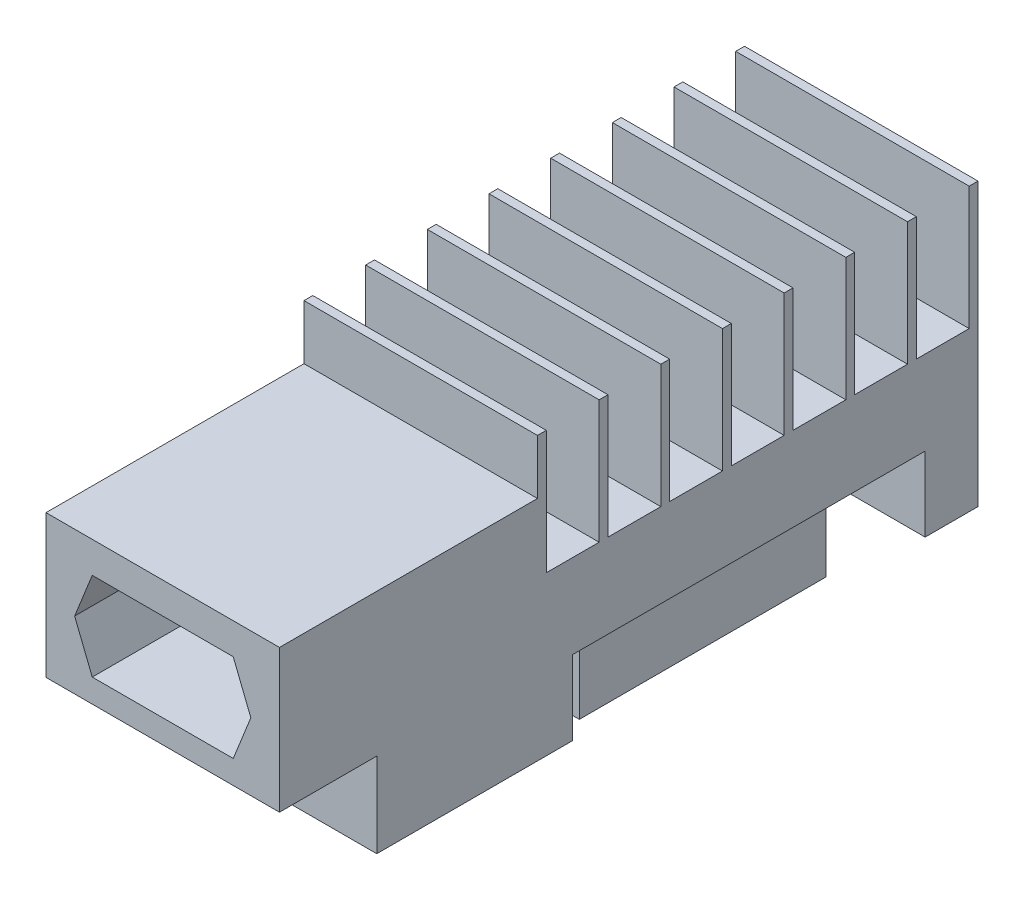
SolidWorks part; units mm, degrees
ref_plane "Plane1" through (0, 0, 0) normal (0, 0, 1) x (1, 0, 0)
ref_plane "Plane2" through (0, 0, 0) normal (0, 1, 0) x (1, 0, 0)
ref_plane "Plane3" through (0, 0, 0) normal (1, 0, 0) x (0, 0, -1)
ref_plane "Plane5" through (0, 16, 0) normal (0, 1, 0) x (-1, 0, 0)
sketch "Sketch2" plane through (0, 16, 0) normal (0, 1, 0) x (-1, 0, 0)
  line L0 (-6.625, 0) -> (6.625, 0)
  line L1 (6.625, 0) -> (6.625, 39.64)
  line L2 (6.625, 39.64) -> (-6.625, 39.64)
  line L3 (-6.625, 39.64) -> (-6.625, 0)
  dimension "D1" = 13.25
  dimension "D2" = 39.64
extrude "Extrude2" add sketch "Sketch2" against normal blind 16
sketch "Sketch3" plane through (-6.625, 0, 0) normal (-1, 0, 0) x (0, 0, 1)
  line L0 (3.5, 16) -> (0.5, 16)
  line L1 (0.5, 16) -> (0.5, 9)
  line L2 (0.5, 9) -> (3.5, 9)
  line L3 (3.5, 9) -> (3.5, 16)
  line L5 (0, 0) -> (0, 16) construction
  line L6 (0, 16) -> (39.64, 16) construction
  dimension "D1" = 7
  dimension "D2" = 0.5
  dimension "D3" = 3
extrude "Cut-Extrude1" cut sketch "Sketch3" against normal up to next
pattern_linear "LPattern1" count 7 spacing 3.5 along (0, 0, 1) of "Cut-Extrude1"
sketch "Sketch10" plane through (-6.625, 0, 0) normal (-1, 0, 0) x (0, 0, 1)
  line L0 (25, 12.9) -> (39.64, 12.9)
  line L1 (39.64, 12.9) -> (39.64, 16)
  line L2 (39.64, 16) -> (25, 16)
  line L3 (25, 16) -> (25, 12.9)
  line L4 (39.64, 0) -> (39.64, 16) construction
  line L5 (24.5, 16) -> (39.64, 16) construction
  line L6 (24.5, 9) -> (24.5, 16) construction
  dimension "D1" = 0.5
  dimension "D2" = 3.1
extrude "Cut-Extrude8" cut sketch "Sketch10" against normal up to next
sketch "Sketch11" plane through (-6.625, 0, 0) normal (-1, 0, 0) x (0, 0, 1)
  line L0 (39.64, 4.8) -> (34.12, 4.8)
  line L1 (34.12, 4.8) -> (34.12, 0)
  line L2 (34.12, 0) -> (39.64, 0)
  line L3 (39.64, 0) -> (39.64, 4.8)
  line L4 (39.64, 0) -> (39.64, 12.9) construction
  line L5 (0, 0) -> (39.64, 0) construction
  dimension "D1" = 5.52
  dimension "D2" = 4.8
extrude "Cut-Extrude9" cut sketch "Sketch11" against normal up to next
sketch "Sketch12" plane through (-6.625, 0, 0) normal (-1, 0, 0) x (0, 0, 1)
  line L0 (3, 0) -> (23, 0)
  line L1 (23, 0) -> (23, 4.23)
  line L2 (23, 4.23) -> (3, 4.23)
  line L3 (3, 4.23) -> (3, 0)
  line L4 (0, 0) -> (34.12, 0) construction
  line L5 (0, 0) -> (0, 16) construction
  dimension "D1" = 3
  dimension "D2" = 20
  dimension "D3" = 4.23
extrude "Cut-Extrude10" cut sketch "Sketch12" against normal up to next
sketch "Sketch13" plane through (0, 0, 39.64) normal (0, 0, 1) x (1, 0, 0)
  line L0 (4, 6.13) -> (5, 8.63)
  line L1 (5, 8.63) -> (4, 11.13)
  line L2 (4, 11.13) -> (-4, 11.13)
  line L3 (-4, 11.13) -> (-5, 8.63)
  line L4 (-5, 8.63) -> (-4, 6.13)
  line L5 (-4, 6.13) -> (4, 6.13)
  line L6 (0, 0) -> (0, 12.4513) construction
  line L8 (-5, 8.63) -> (5, 8.63) construction
  line L9 (6.625, 0) -> (-6.625, 0) construction
  dimension "D1" = 8.63
  dimension "D2" = 10
  dimension "D3" = 5
  dimension "D4" = 8
extrude "Cut-Extrude11" cut sketch "Sketch13" against normal blind 8
hole_wizard "Hole1" positions "Sketch15" profile "Sketch14" legacy
sketch "Sketch15" plane through (0, 0, 31.64) normal (0, 0, 1) x (1, 0, 0)
  line L0 (-5, 8.63) -> (5, 8.63) construction
  line L1 (0, 0) -> (0, 11.6345) construction
  point P0 (-2.3, 8.63)
  point P10 (2.3, 8.63)
  dimension "D1" = 4.6
sketch "Sketch14" plane through (-2.3, 8.63, 31.64) normal (1, 0, 0) x (0, -1, 0)
  line L0 (0, 0) -> (0, 3)
  line L1 (0, 3) -> (0.35, 3)
  line L2 (0.35, 3) -> (0.35, 0)
  line L3 (0.35, 0) -> (0, 0)
  line L4 (0, 110) -> (0, -10) construction
  dimension "Diameter" = 0.7
  dimension "Depth" = 3
sketch "Sketch18" plane through (0, 4.23, 0) normal (0, 1, 0) x (-1, 0, 0)
  line L0 (-6, 8) -> (6, 8)
  line L1 (6, 8) -> (6, 22)
  line L2 (6, 22) -> (-6, 22)
  line L3 (-6, 22) -> (-6, 8)
  line L4 (0, 0) -> (0, 8) construction
  line L5 (-6.625, 0) -> (6.625, 0) construction
  dimension "D1" = 8
  dimension "D2" = 14
  dimension "D3" = 12
extrude "Extrude3" add sketch "Sketch18" against normal blind 4 separate body
